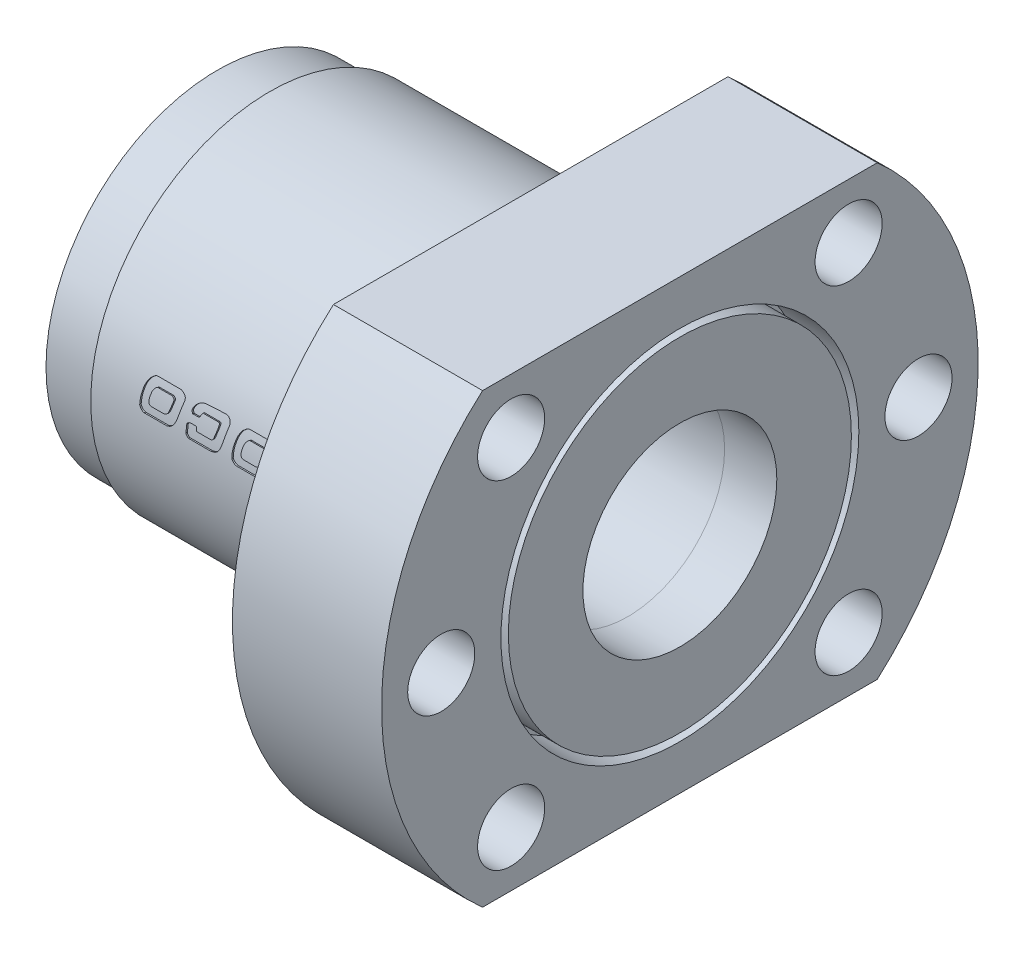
SolidWorks part; units mm, degrees
other "____3[1]"
other "____1[1]"
ref_plane "Front Plane" through (0, 0, 0) normal (0, 0, 1) x (1, 0, 0)
ref_plane "Top Plane" through (0, 0, 0) normal (0, 1, 0) x (1, 0, 0)
ref_plane "Right Plane" through (0, 0, 0) normal (1, 0, 0) x (0, 0, -1)
imported_body "Imported1"
imported_body "Imported2"
sketch "Sketch1" plane through (0, 0, 0) normal (1, 0, 0) x (0, 0, -1)
  circle A0 centre (0, 0) radius 6
extrude "Cut-Extrude1" cut sketch "Sketch1" against normal up to surface (60 mm away)
